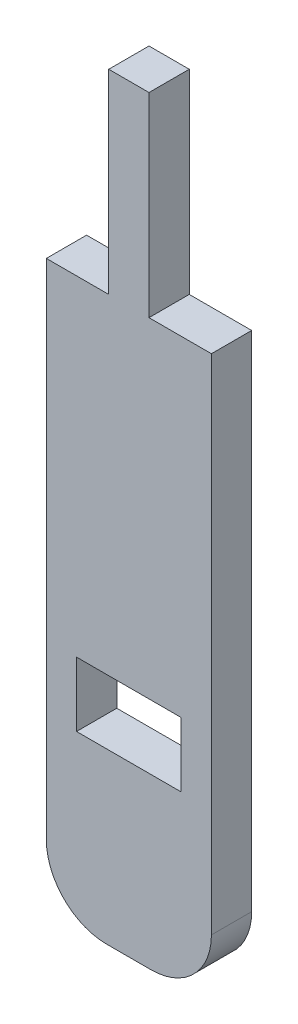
SolidWorks part; units mm, degrees
ref_plane "Plan de face" through (0, 0, 0) normal (0, 0, 1) x (1, 0, 0)
ref_plane "Plan de dessus" through (0, 0, 0) normal (0, 1, 0) x (1, 0, 0)
ref_plane "Plan de droite" through (0, 0, 0) normal (1, 0, 0) x (0, 0, -1)
sketch "Esquisse1" plane through (0, 0, 0) normal (0, 0, 1) x (1, 0, 0)
  line L0 (-4.1, 18) -> (-4.1, -7)
  line L1 (-2.6, 1.6) -> (2.6, 1.6)
  line L2 (-2.6, 1.6) -> (-2.6, -1.6)
  line L3 (-2.6, -1.6) -> (2.6, -1.6)
  line L4 (2.6, 1.6) -> (2.6, -1.6)
  line L5 (-1.1, -10) -> (1.1, -10)
  line L6 (4.1, -7) -> (4.1, 18)
  line L7 (-4.1, 18) -> (4.1, 18)
  line L8 (-1, 27.6857) -> (1, 27.6857)
  line L9 (-1, 27.6857) -> (-1, 18)
  line L10 (-1, 18) -> (1, 18)
  line L11 (1, 27.6857) -> (1, 18)
  arc A0 (4.1, -7) -> (1.1, -10) centre (1.1, -7) cw
  arc A1 (-4.1, -7) -> (-1.1, -10) centre (-1.1, -7) ccw
  point P4 (0, 1.6)
  point P6 (-2.6, 0)
  point P9 (0, -10)
  point P18 (-4.1, -10)
  point P21 (0, 18)
  point P22 (1.0809, 12)
  dimension "D7" = 3
  dimension "D1" = 5.2
  dimension "D2" = 3.2
  dimension "D3" = 28
  dimension "D4" = 10
  dimension "D5" = 2
  dimension "D6" = 1.5
extrude "Boss.-Extru.1" add sketch "Esquisse1" along normal blind 2 contours L0 A1 L5 A0 L6 L7 L1 L4 L3 L2 | L11 L8 L9 L7
